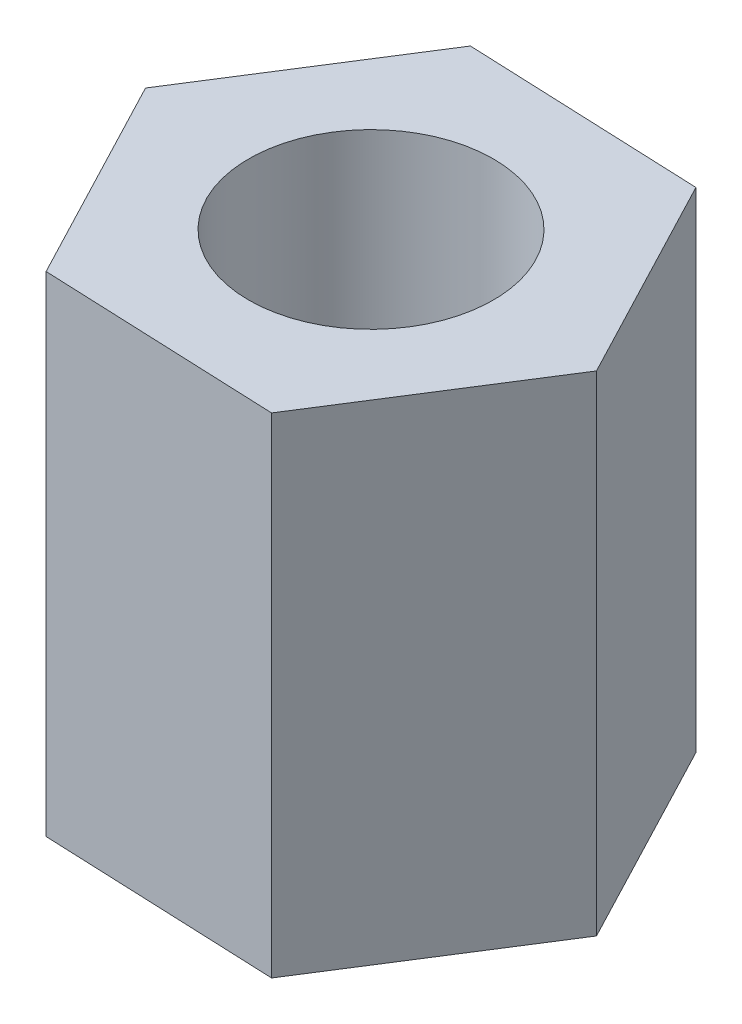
SolidWorks part; units mm, degrees
ref_plane "Ebene vorne" through (0, 0, 0) normal (0, 0, 1) x (1, 0, 0)
ref_plane "Ebene oben" through (0, 0, 0) normal (0, 1, 0) x (1, 0, 0)
ref_plane "Ebene rechts" through (0, 0, 0) normal (1, 0, 0) x (0, 0, -1)
sketch "Skizze1" plane through (0, 0, 0) normal (0, 1, 0) x (1, 0, 0)
  line L1 (1.3385, -2.5577) -> (2.8843, -0.1196)
  line L2 (2.8843, -0.1196) -> (1.5457, 2.438)
  line L3 (1.5457, 2.438) -> (-1.3385, 2.5577)
  line L4 (-1.3385, 2.5577) -> (-2.8843, 0.1196)
  line L5 (-2.8843, 0.1196) -> (-1.5457, -2.438)
  line L6 (-1.5457, -2.438) -> (1.3385, -2.5577)
  circle A0 centre (0, 0) radius 2.5 construction
  circle A1 centre (0, 0) radius 1.5
  dimension "D1" = 5
  dimension "D2" = 3
extrude "Aufsatz-Linear austragen1" add sketch "Skizze1" along normal blind 6
